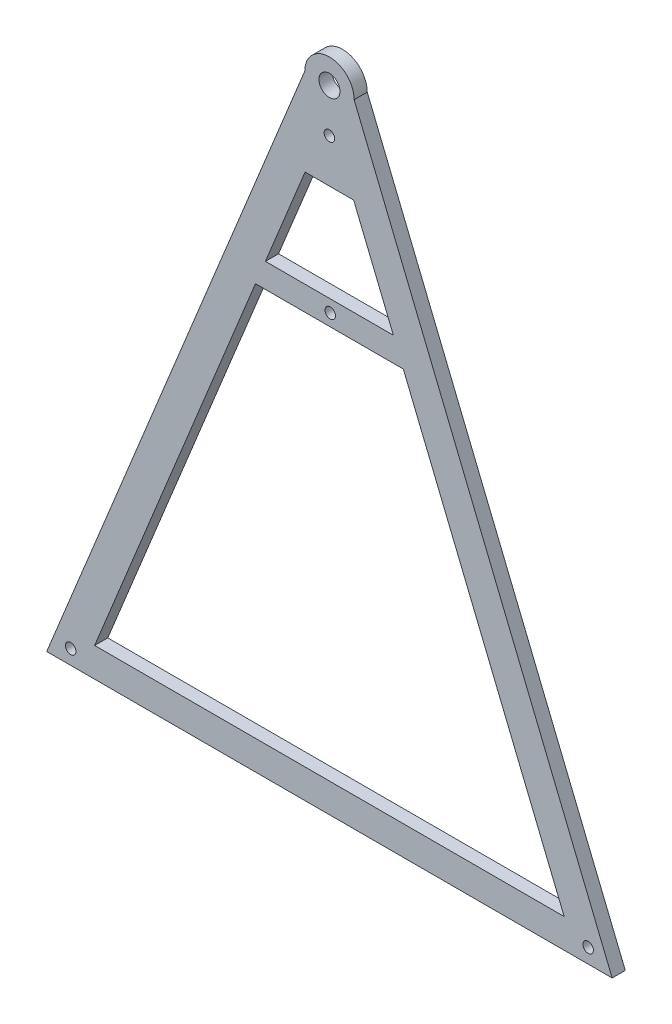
SolidWorks part; units mm, degrees
ref_plane "Front Plane" through (0, 0, 0) normal (0, 0, 1) x (1, 0, 0)
ref_plane "Top Plane" through (0, 0, 0) normal (0, 1, 0) x (1, 0, 0)
ref_plane "Right Plane" through (0, 0, 0) normal (1, 0, 0) x (0, 0, -1)
sketch "Sketch1" plane through (0, 0, 0) normal (0, 0, 1) x (1, 0, 0)
  line L0 (-11.9419, 0) -> (-136.7702, -305.5545)
  line L1 (0, 0) -> (11.9419, 0) construction
  line L2 (0, 0) -> (-11.9419, 0) construction
  line L3 (11.9419, 0) -> (136.7702, -305.5545)
  line L4 (-136.7702, -305.5545) -> (136.7702, -305.5545)
  line L5 (11.729, -42.1747) -> (-11.7704, -42.1747)
  line L6 (113.5524, -291.4179) -> (-113.5937, -291.4179)
  line L7 (113.5524, -291.4179) -> (11.729, -42.1747)
  line L8 (-11.7704, -42.1747) -> (-113.5937, -291.4179)
  circle A0 centre (0, 0) radius 5.08
  circle A1 centre (0, 0) radius 11.9419
extrude "Boss-Extrude2" add sketch "Sketch1" along normal blind 6.35 contours A1 L0 L4 L3 L8 L5 L7 L6 | A1 A0
sketch "Sketch2" plane through (0, 0, 6.35) normal (0, 0, 1) x (1, 0, 0)
  line L0 (113.5524, -291.4179) -> (136.7702, -305.5545) construction
  line L1 (-113.5937, -291.4179) -> (-136.7702, -305.5545) construction
  circle A0 centre (125.1613, -298.4862) radius 2.54
extrude "Cut-Extrude1" cut sketch "Sketch2" against normal blind 6.35
sketch "Sketch3" plane through (0, 0, 6.35) normal (0, 0, 1) x (1, 0, 0)
  line L0 (-113.5937, -291.4179) -> (-136.7702, -305.5545) construction
  line L1 (-136.7702, -305.5545) -> (136.7702, -305.5545) construction
  line L2 (-11.9419, 0) -> (-136.7702, -305.5545) construction
  circle A0 centre (-125.182, -298.4862) radius 2.54
extrude "Cut-Extrude2" cut sketch "Sketch3" against normal blind 6.35
sketch "Sketch4" plane through (0, 0, 6.35) normal (0, 0, 1) x (1, 0, 0)
  line L0 (0, 0) -> (-0.0207, -42.1747) construction
  line L1 (11.729, -42.1747) -> (-11.7704, -42.1747) construction
  circle A0 centre (-0.0103, -21.0873) radius 2.54
extrude "Cut-Extrude3" cut sketch "Sketch4" against normal blind 6.35
sketch "Sketch5" plane through (0, 0, 6.35) normal (0, 0, 1) x (1, 0, 0)
  line L0 (-30.9786, -89.1927) -> (30.9373, -89.1927)
  line L1 (-11.7704, -42.1747) -> (-113.5937, -291.4179) construction
  line L2 (113.5524, -291.4179) -> (11.729, -42.1747) construction
  line L3 (-35.7816, -100.9494) -> (35.7403, -100.9494)
  line L6 (30.9373, -89.1927) -> (35.7403, -100.9494)
  line L7 (-30.9786, -89.1927) -> (-35.7816, -100.9494)
extrude "Boss-Extrude4" add sketch "Sketch5" against normal blind 6.35
sketch "Sketch6" plane through (0, 0, 6.35) normal (0, 0, 1) x (1, 0, 0)
  line L0 (-31.1877, -95.1115) -> (32.005, -95.1115) construction
  line L1 (-0.0103, -21.0873) -> (0.4087, -95.1115) construction
  circle A0 centre (0.4087, -95.1115) radius 2.54
extrude "Cut-Extrude4" cut sketch "Sketch6" against normal blind 6.35
